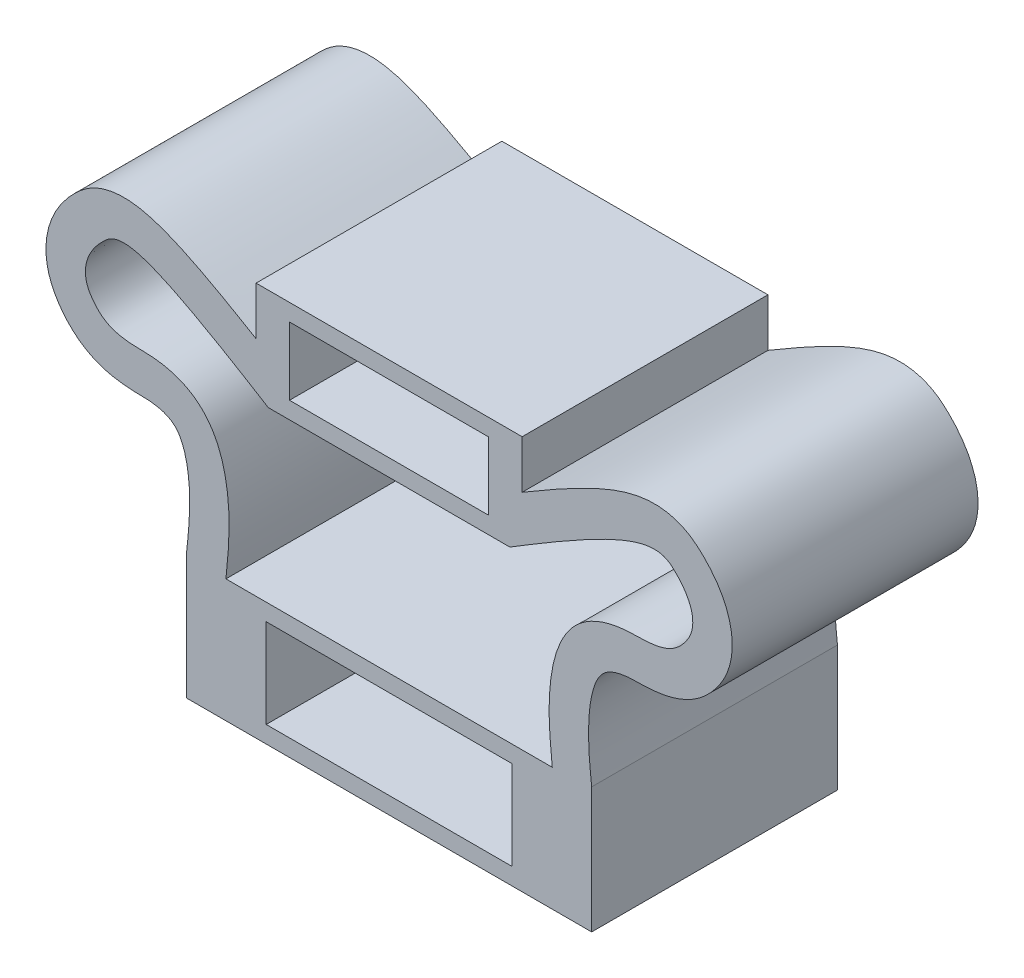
SolidWorks part; units mm, degrees
ref_plane "前视基准面" through (0, 0, 0) normal (0, 0, 1) x (1, 0, 0)
ref_plane "上视基准面" through (0, 0, 0) normal (0, 1, 0) x (1, 0, 0)
ref_plane "右视基准面" through (0, 0, 0) normal (1, 0, 0) x (0, 0, -1)
sketch "Model" plane through (0, 0, 0) normal (0, 0, 1) x (1, 0, 0)
  line L0 (3.85, 0) -> (0, 0)
  line L1 (1, 4) -> (3.85, 4)
  line L2 (3.85, 4) -> (3.85, 4.4)
  line L3 (3.85, 4.4) -> (1.5, 4.4)
  line L4 (1.5, 4.4) -> (1.5, 6)
  line L5 (1.5, 6) -> (3.85, 6)
  line L6 (3.85, 6) -> (3.85, 6.4)
  line L7 (3.85, 6.4) -> (0.711, 6.4)
  line L8 (0.711, 6.4) -> (0.711, 5.2643)
  line L9 (-0.93, 0.0648) -> (-0.93, -2.9)
  line L10 (-0.93, -2.9) -> (3.85, -2.9)
  line L11 (3.85, -2.9) -> (3.85, -2.5)
  line L12 (3.85, -2.5) -> (0.95, -2.5)
  line L13 (0.95, -2.5) -> (0.95, -0.4)
  line L14 (0.95, -0.4) -> (3.85, -0.4)
  line L15 (3.85, -0.4) -> (3.85, 0)
  spline S0 degree 3 number of poles 148 (0, 0) -> (1, 4)
  spline S1 degree 3 number of poles 145 (0.711, 5.2643) -> (-0.93, 0.0648)
extrude "凸台-拉伸1" add sketch "Model" along normal blind 5.8
ref_plane "基准面4" through (3.85, 0, 0) normal (1, 0, 0) x (0, 0, -1)
mirror "镜向1" about plane through (3.85, 0, 0) normal (1, 0, 0) of "凸台-拉伸1"
